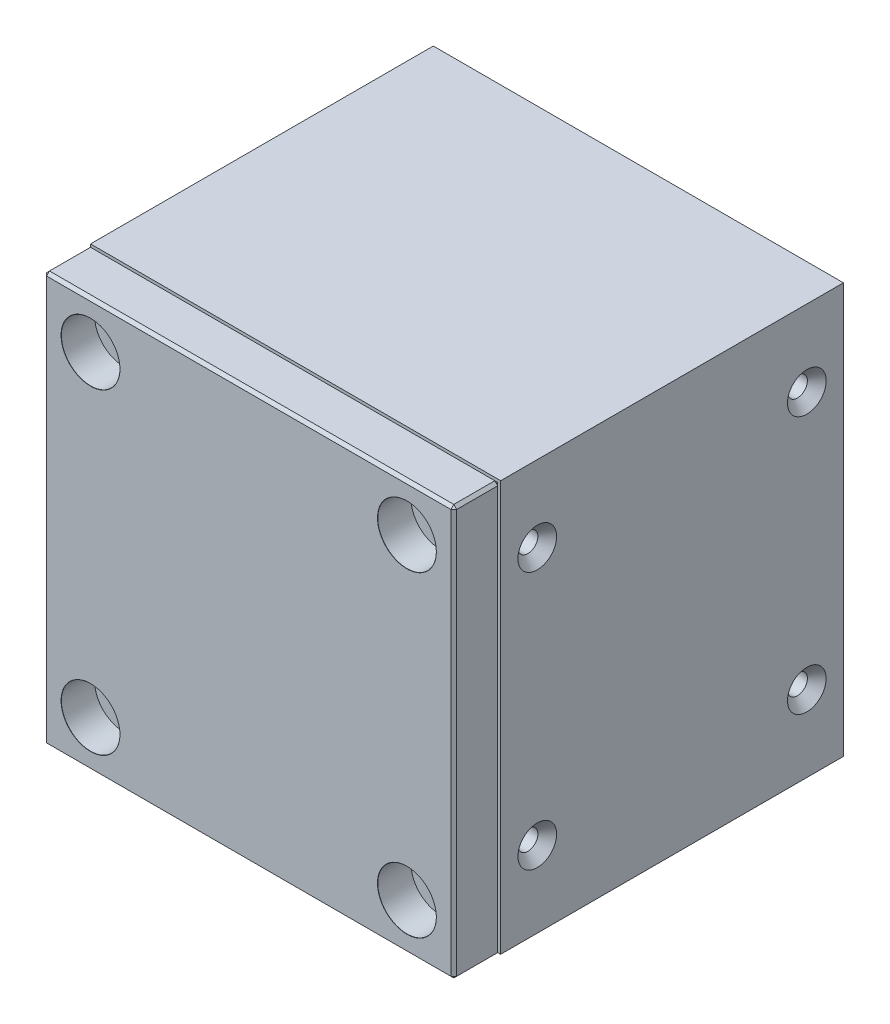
SolidWorks part; units mm, degrees
ref_plane "前视基准面" through (0, 0, 0) normal (0, 0, 1) x (1, 0, 0)
ref_plane "上视基准面" through (0, 0, 0) normal (0, 1, 0) x (1, 0, 0)
ref_plane "右视基准面" through (0, 0, 0) normal (1, 0, 0) x (0, 0, -1)
sketch "草图1" plane through (0, 0, 0) normal (0, 0, 1) x (1, 0, 0)
  line L1 (-35, -35) -> (35, -35)
  line L2 (-35, -35) -> (-35, 35)
  line L3 (-35, 35) -> (35, 35)
  line L4 (35, -35) -> (35, 35)
  line L5 (-35, -35) -> (35, 35) construction
  line L6 (-35, 35) -> (35, -35) construction
  point P0 (0, 0)
  dimension "D1" = 70
  dimension "D2" = 70
extrude "凸台-拉伸1" add sketch "草图1" along normal blind 58.5
sketch "草图2" plane through (0, 0, 58.5) normal (0, 0, 1) x (1, 0, 0)
  line L0 (35, 35) -> (-35, 35) construction
  line L1 (-35, -35) -> (35, -35)
  line L2 (-35, -35) -> (-35, 35)
  line L3 (-35, 35) -> (35, 35)
  line L4 (35, -35) -> (35, 35)
  line L5 (-35, -35) -> (35, 35) construction
  line L6 (-35, 35) -> (35, -35) construction
  line L7 (35, -35) -> (35, 35) construction
  point P0 (0, 0)
extrude "凸台-拉伸2" add sketch "草图2" along normal blind 8 separate body
chamfer "倒角1" distance 0.5 angle 45 12 edges at (0, 35, 58.5) (35, 35, 62.5) (35, 0, 58.5) (35, -35, 62.5) (0, -35, 58.5) (0, -35, 66.5) (35, 0, 66.5) (0, 35, 66.5) (-35, 35, 62.5) (-35, 0, 66.5) (-35, -35, 62.5) (-35, 0, 58.5)
hole_wizard "打孔尺寸(%根据)内六角圆柱头螺钉的类型1" positions "草图3" profile "草图4" counterbore size "M5" standard "GB"
sketch "草图3" plane through (0, 0, 66.5) normal (0, 0, 1) x (1, 0, 0)
  line L0 (0, 0) -> (-27.3334, 0) construction
  line L1 (0, 0) -> (0, -33.4378) construction
  point P0 (-27, -27)
  point P10 (0, 0)
  point P11 (-27, 27)
  point P12 (27, 27)
  point P13 (27, -27)
  dimension "D1" = 54
  dimension "D2" = 54
sketch "草图4" plane through (-27, -27, 66.5) normal (1, 0, 0) x (0, -1, 0)
  line L0 (0, 0) -> (0, 66.5)
  line L1 (0, 66.5) -> (2.75, 66.5)
  line L3 (2.75, 66.5) -> (2.75, 5.7)
  line L4 (5, 5.7) -> (2.75, 5.7)
  line L5 (5, 5.7) -> (5, 0.025)
  line L6 (5, 0.025) -> (5.025, 0)
  line L7 (5.025, 0) -> (0, 0)
  line L8 (-5, 0.025) -> (-5.025, 0) construction
  line L11 (0, -6.35) -> (0, 107.95) construction
  dimension "通孔孔直径" = 5.5
  dimension "通孔孔深度" = 66.5
  dimension "柱形沉头孔直径" = 10
  dimension "柱形沉头孔深度" = 5.7
  dimension "近端锥形沉头孔直径" = 10.05
  dimension "近端锥形沉头孔角度" = 90
hole_wizard "打孔尺寸(%根据十字)槽半沉头木螺钉的类型1" positions "草图5" profile "草图6" countersink size "M3" standard "GB"
sketch "草图5" plane through (35, 0, 0) normal (1, 0, 0) x (0, 0, -1)
  line L0 (-29.25, -35) -> (-29.25, -15.9611) construction
  line L1 (-58.5, -35) -> (0, -35) construction
  line L2 (0, 0) -> (-29.25, 0) construction
  point P0 (-52.25, 22)
  point P2 (-52.25, -22)
  point P10 (-6.25, -22)
  point P11 (-6.25, 22)
  point P16 (0, 0)
  dimension "D1" = 46
  dimension "D2" = 44
sketch "草图6" plane through (35, 22, 52.25) normal (0, 1, 0) x (0, 0, -1)
  line L0 (0, 0) -> (0, 70)
  line L1 (0, 70) -> (1.7, 70)
  line L2 (1.7, 70) -> (1.7, 1.6)
  line L3 (1.7, 1.6) -> (3.3, 0)
  line L5 (3.3, 0) -> (0, 0)
  line L6 (-1.7, 1.6) -> (-3.3, 0) construction
  line L11 (0, -6.35) -> (0, 107.95) construction
  dimension "通孔孔直径" = 3.4
  dimension "通孔孔深度" = 70
  dimension "近端锥形沉头孔直径" = 6.6
  dimension "近端锥形沉头孔角度" = 90
mirror "镜向1" about plane through (0, 0, 0) normal (1, 0, 0) of "打孔尺寸(%根据十字)槽半沉头木螺钉的类型1"
